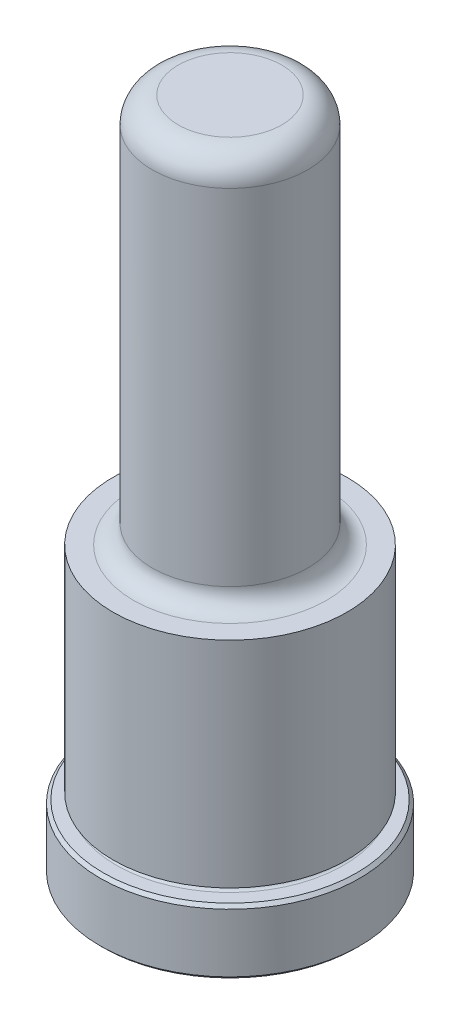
SolidWorks part; units mm, degrees
ref_plane "Front Plane" through (0, 0, 0) normal (0, 0, 1) x (1, 0, 0)
ref_plane "Top Plane" through (0, 0, 0) normal (0, 1, 0) x (1, 0, 0)
ref_plane "Right Plane" through (0, 0, 0) normal (1, 0, 0) x (0, 0, -1)
sketch "Sketch1" plane through (0, 0, 0) normal (1, 0, 0) x (0, 0, -1)
  line L0 (0, 0) -> (15.875, 0)
  line L1 (15.875, 0) -> (15.875, 7.9248)
  line L2 (15.875, 7.9248) -> (13.8938, 7.9248)
  line L3 (13.5128, 2.6782) -> (13.5128, 5.9795) construction
  line L4 (13.8938, 8.6868) -> (14.3002, 8.6868)
  line L5 (14.3002, 8.6868) -> (14.3002, 34.925)
  line L6 (14.3002, 34.925) -> (11.7983, 34.925)
  line L7 (9.5123, 37.211) -> (9.5123, 82.55)
  line L9 (9.5123, 82.55) -> (0, 82.55)
  line L10 (0, 82.55) -> (0, 0)
  line L11 (0, 0) -> (0, -7.2694) construction
  arc A0 (13.8938, 8.6868) -> (13.8938, 7.9248) centre (13.8938, 8.3058) ccw
  arc A1 (11.7983, 34.925) -> (9.5123, 37.211) centre (11.7983, 37.211) cw
  point P2 (9.5123, 82.55)
  point P14 (9.5123, 82.3355)
  point P19 (9.5123, 34.925)
  dimension "D14" = 0.762
  dimension "D8" = 2.286
  dimension "T" = 7.9248
  dimension "D2" = 0.762
  dimension "M" = 31.75
  dimension "B" = 28.6004
  dimension "L" = 82.55
  dimension "D7" = 0.7874
  dimension "A" = 34.925
  dimension "D" = 19.0246
  dimension "D15" = 47.625
revolve "Revolve1" add sketch "Sketch1" angle 360 about L11
chamfer "Chamfer1" distance 0.381 angle 45 2 edges at (0, 0, 15.875) (0, 7.9248, 15.875)
fillet "Fillet1" radius 3.175 1 edges at (0, 82.55, 9.5123)
